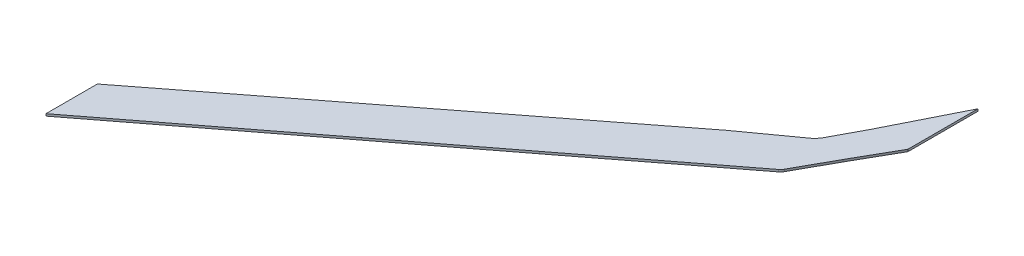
SolidWorks part; units mm, degrees
ref_plane "Plan de face" through (0, 0, 0) normal (0, 0, 1) x (1, 0, 0)
ref_plane "Plan de dessus" through (0, 0, 0) normal (0, 1, 0) x (1, 0, 0)
ref_plane "Plan de droite" through (0, 0, 0) normal (1, 0, 0) x (0, 0, -1)
ref_plane "Plan1" through (0, -830, 0) normal (0, -1, 0) x (-1, 0, 0)
sketch "Esquisse22" plane through (0, -830, 0) normal (0, -1, 0) x (-1, 0, 0)
  line L0 (-835.042, -2312.32) -> (-10.001, -2945.0021)
  line L19 (-835.042, -2312.32) -> (-1300.508, -1956.104)
  line L20 (-1690.021, -1656.543) -> (-1300.508, -1956.104)
  line L21 (-1923.6277, -1477.6193) -> (-1690.021, -1656.543)
  line L22 (-1936.9645, -1462.1495) -> (-2033.118, -1288.44)
  line L23 (-2142.0031, -1097.296) -> (-2033.118, -1288.44)
  line L24 (-2142.0031, -1097.296) -> (-2142.0031, -774.0381)
  line L25 (-2142.0031, -774.0381) -> (-1975.7128, -1106.0504)
  line L26 (-1975.7128, -1106.0504) -> (-1900.589, -1246.655)
  line L27 (-1900.589, -1246.655) -> (-1893.1468, -1258.2593)
  line L28 (-1893.1468, -1258.2593) -> (-1884.1794, -1268.7297)
  line L29 (-1873.8573, -1277.8674) -> (-1884.1794, -1268.7297)
  line L30 (-1873.8573, -1277.8674) -> (-1873.0125, -1278.51)
  line L31 (-1873.0125, -1278.51) -> (-1872.1612, -1279.1435)
  line L32 (-1872.1612, -1279.1435) -> (-1871.3031, -1279.768)
  line L33 (-1871.3031, -1279.768) -> (-1646.449, -1441.573)
  line L34 (-1646.449, -1441.573) -> (-10.004, -2707.896)
  line L35 (-10.004, -2707.896) -> (-10.001, -2945.0021)
  arc A0 (-1936.9645, -1462.1495) -> (-1923.6277, -1477.6193) centre (-1893.2236, -1437.9235) ccw
extrude "Boss.-Extru.1" add sketch "Esquisse22" along normal blind 10
fillet "Congé3" radius 50 4 edges at (1871.3031, -835, 1279.768) (1884.1794, -835, 1268.7297) (1893.1468, -835, 1258.2593) (1900.589, -835, 1246.655)
